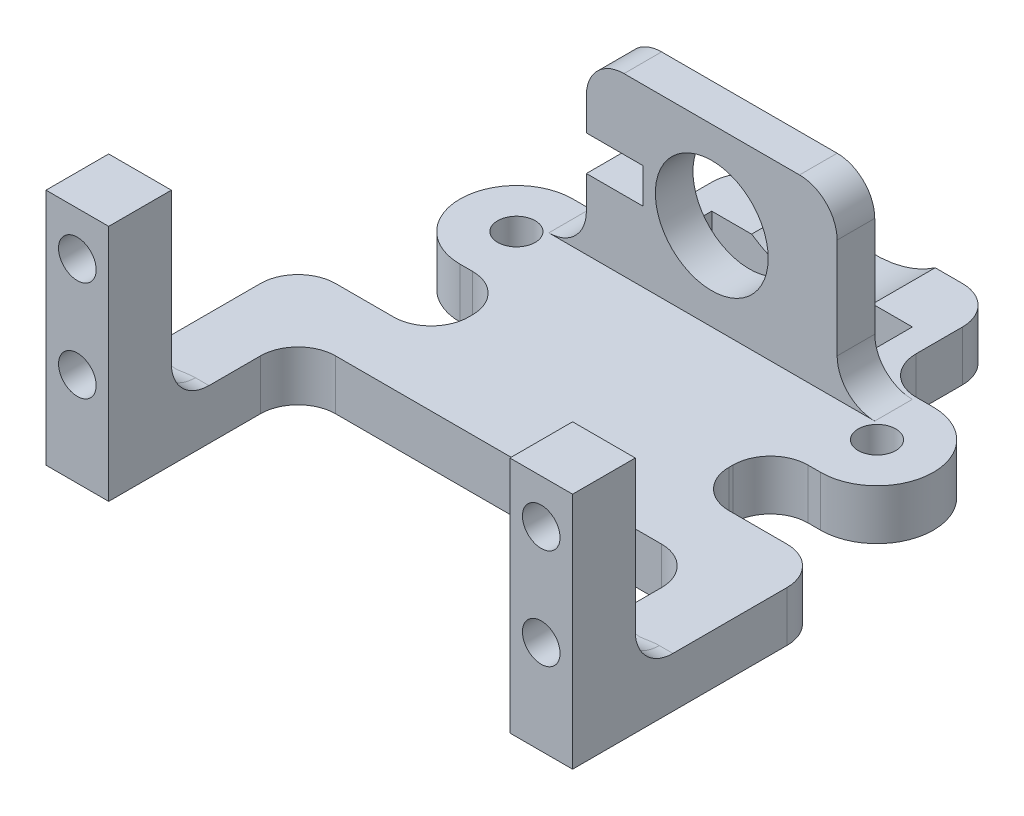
SolidWorks part; units mm, degrees
ref_plane "Front Plane" through (0, 0, 0) normal (0, 0, 1) x (1, 0, 0)
ref_plane "Top Plane" through (0, 0, 0) normal (0, 1, 0) x (1, 0, 0)
ref_plane "Right Plane" through (0, 0, 0) normal (1, 0, 0) x (0, 0, -1)
body saved out of another part "Stock-hemispherical_hot_cold_side_extended-1"
fillet "Fillet1" radius 3 16 edges at (-74.13, -11, -38.9) (-74.13, -11, -32.6) (-73.75, -11, -47.9) (-53.75, -11, -47.9) (-53.37, -11, -32.6) (-53.37, -11, -38.9) (-53.75, -11, -57.6) (-53.75, 5, -46.1) (-73.75, 5, -46.1) (-73.75, -11, -57.6) (-45.25, -9, -17.5) (-82.25, -9, -17.5) (-84.75, -11, -32.6) (-42.75, -11, -32.6) (-79.75, -11, -27.6) (-47.75, -11, -27.6)
sketch "Sketch1" plane through (0, 0, -17.5) normal (0, 0, -1) x (-1, 0, 0)
  arc A0 (80.8358, -6) -> (83.6642, -6) centre (82.25, -5.5) ccw construction
  arc A1 (83.6642, -6) -> (80.8358, -6) centre (82.25, -5.5) ccw construction
  arc A2 (43.8358, -6) -> (46.6642, -6) centre (45.25, -5.5) ccw construction
  arc A3 (46.6642, -6) -> (43.8358, -6) centre (45.25, -5.5) ccw construction
  arc A4 (80.8358, -6) -> (83.6642, -6) centre (82.25, -5.5) ccw
  arc A5 (83.6642, -6) -> (80.8358, -6) centre (82.25, -5.5) ccw
  arc A6 (43.8358, -6) -> (46.6642, -6) centre (45.25, -5.5) ccw
  arc A7 (46.6642, -6) -> (43.8358, -6) centre (45.25, -5.5) ccw
  arc A8 (42.893, -6.3333) -> (47.607, -6.3333) centre (45.25, -5.5) ccw
  arc A9 (47.607, -6.3333) -> (42.893, -6.3333) centre (45.25, -5.5) ccw
  arc A10 (79.893, -6.3333) -> (84.607, -6.3333) centre (82.25, -5.5) ccw
  arc A11 (84.607, -6.3333) -> (79.893, -6.3333) centre (82.25, -5.5) ccw
  dimension "D1" = 1
extrude "Cut-Extrude1" cut sketch "Sketch1" along normal blind 10 contours A8 A9 A7 A6 | A11 A10 A4 M6 M8
